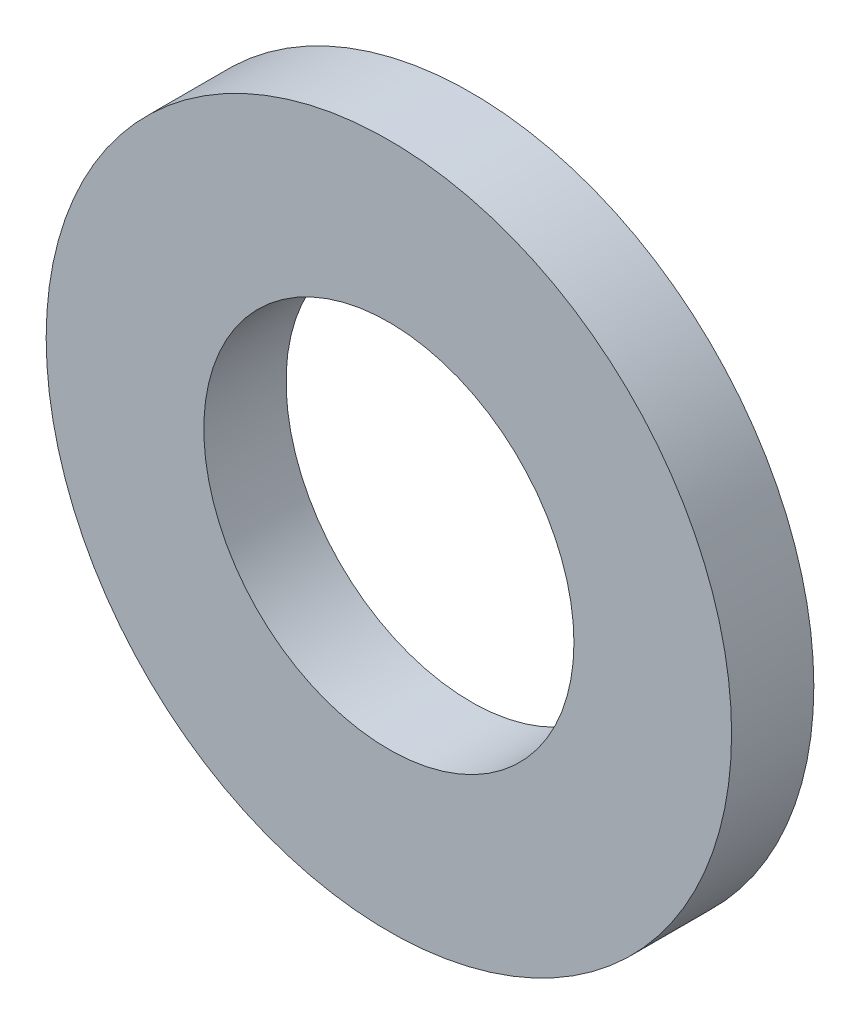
SolidWorks part; units mm, degrees
ref_plane "Plan1" through (0, 0, 0) normal (0, 0, 1) x (1, 0, 0)
ref_plane "Plan2" through (0, 0, 0) normal (0, 1, 0) x (1, 0, 0)
ref_plane "Plan3" through (0, 0, 0) normal (1, 0, 0) x (0, 0, -1)
sketch "Esquisse1" plane through (0, 0, 0) normal (0, 0, 1) x (1, 0, 0)
  circle A0 centre (0, 0) radius 25
  circle A1 centre (0, 0) radius 13.5
  dimension "D1" = 27
  dimension "D2" = 50
extrude "Base-Extrusion" add sketch "Esquisse1" against normal blind 6
